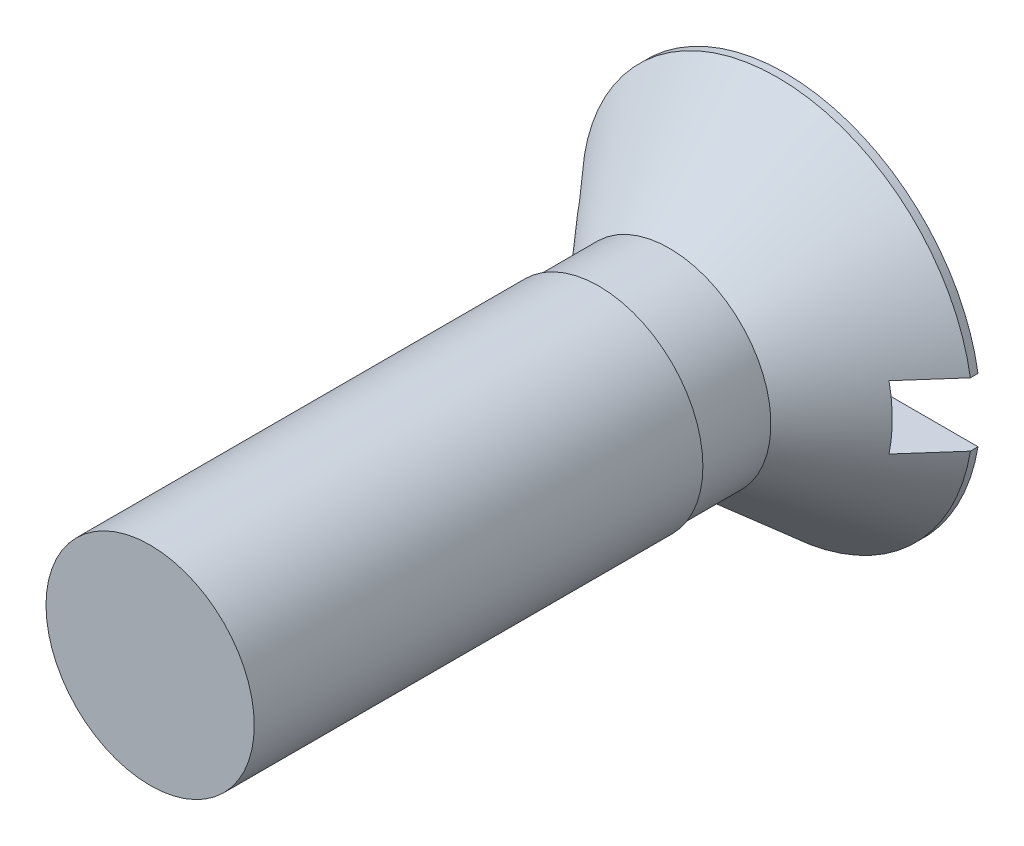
SolidWorks part; units mm, degrees
ref_plane "Спереди" through (0, 0, 0) normal (0, 0, 1) x (1, 0, 0)
ref_plane "Сверху" through (0, 0, 0) normal (0, 1, 0) x (1, 0, 0)
ref_plane "Справа" through (0, 0, 0) normal (1, 0, 0) x (0, 0, -1)
sketch "Эскиз1" plane through (0, 0, 0) normal (1, 0, 0) x (0, 0, -1)
  line L0 (0, 0) -> (-13.918, 0) construction
  line L1 (0, 0) -> (0, 3.9116)
  line L2 (0, 3.9116) -> (-0.1524, 3.9116)
  line L3 (-0.1524, 3.9116) -> (-2.3146, 2.032)
  line L4 (-2.3146, 2.032) -> (-3.7257, 2.032)
  line L5 (-3.7257, 2.032) -> (-3.7257, 2.0828)
  line L6 (-3.7257, 2.0828) -> (-12.7, 2.0828)
  line L7 (-12.7, 2.0828) -> (-12.7, 0)
  line L8 (-12.7, 0) -> (0, 0)
  dimension "D1" = 0.1524
  dimension "D2" = 12.7
  dimension "D3" = 7.8232
  dimension "D4" = 41
  dimension "D5" = 4.064
  dimension "D6" = 4.1656
  dimension "D7" = 1.4111
revolve "Повернуть1" add sketch "Эскиз1" angle 360 about L0
sketch "Эскиз2" plane through (0, 0, 0) normal (1, 0, 0) x (0, 0, -1)
  line L1 (0, 0.635) -> (-1.016, 0.635)
  line L2 (0, 0.635) -> (0, -0.635)
  line L3 (0, -0.635) -> (-1.016, -0.635)
  line L4 (-1.016, 0.635) -> (-1.016, -0.635)
  dimension "D1" = 1.27
  dimension "D2" = 1.016
extrude "Вырез-Вытянуть1" cut sketch "Эскиз2" against normal mid plane 10.16
